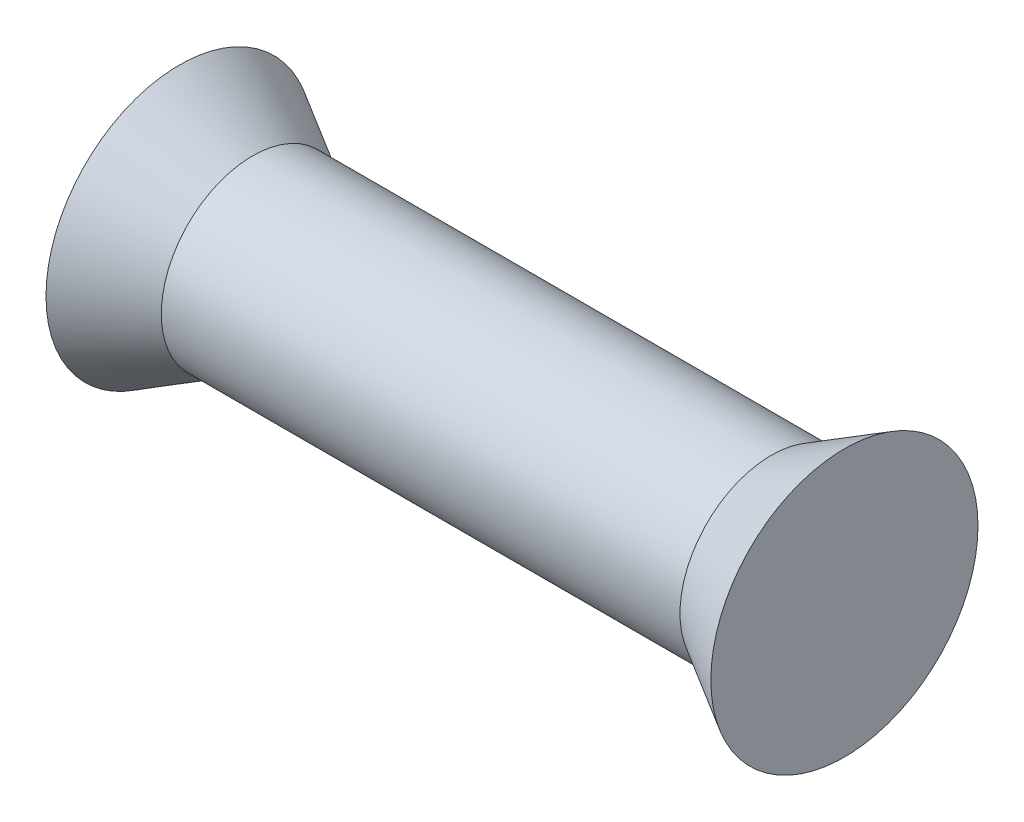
SolidWorks part; units mm, degrees
ref_plane "Спереди" through (0, 0, 0) normal (0, 0, 1) x (1, 0, 0)
ref_plane "Сверху" through (0, 0, 0) normal (0, 1, 0) x (1, 0, 0)
ref_plane "Справа" through (0, 0, 0) normal (1, 0, 0) x (0, 0, -1)
sketch "Эскиз1" plane through (0, 0, 0) normal (0, 0, 1) x (1, 0, 0)
  line L0 (0, 0) -> (-49.4301, 0) construction
  line L1 (0, 0) -> (0, 2.8777)
  line L2 (0, 2.8777) -> (-1.5748, 1.9685)
  line L3 (-1.5748, 1.9685) -> (-12.7508, 1.9685)
  line L4 (-12.7508, 1.9685) -> (-14.3256, 2.8777)
  line L5 (-14.3256, 2.8777) -> (-14.3256, 0)
  line L6 (-14.3256, 0) -> (0, 0)
  dimension "D1" = 30
  dimension "D2" = 30
  dimension "D3" = 3.937
  dimension "D4" = 1.5748
  dimension "D5" = 11.176
revolve "Повернуть1" add sketch "Эскиз1" angle 360 about L0
